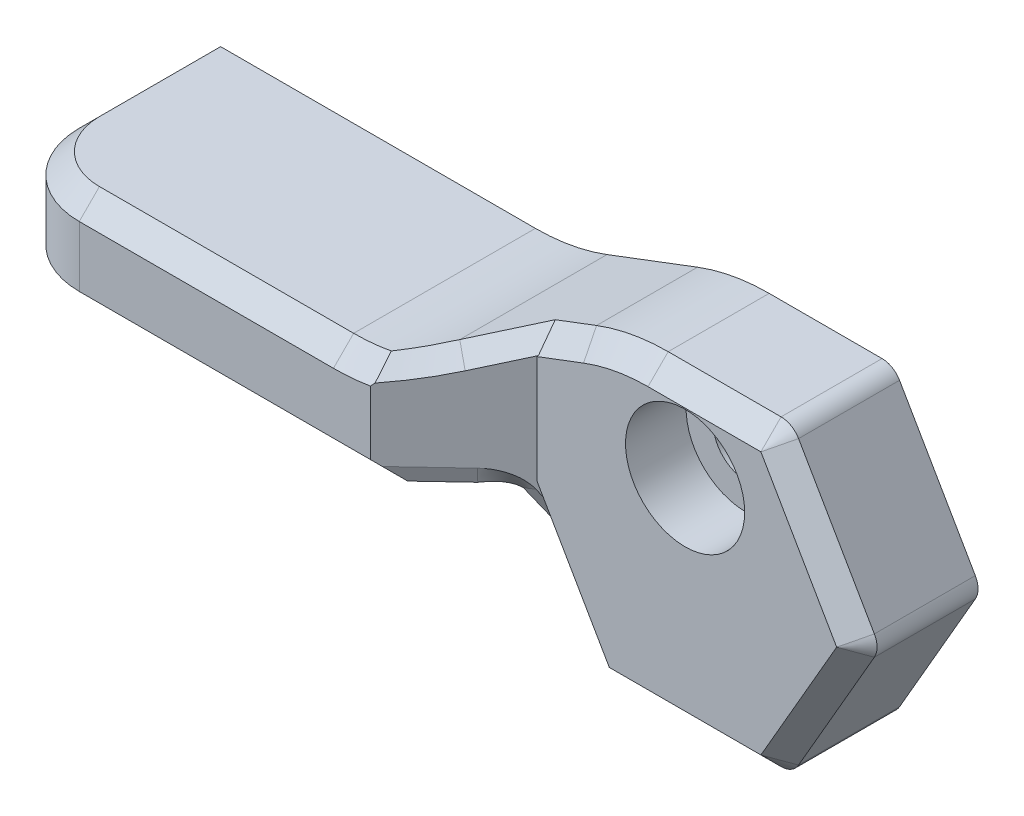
SolidWorks part; units mm, degrees
ref_plane "Спереди" through (0, 0, 0) normal (0, 0, 1) x (1, 0, 0)
ref_plane "Сверху" through (0, 0, 0) normal (0, 1, 0) x (1, 0, 0)
ref_plane "Справа" through (0, 0, 0) normal (1, 0, 0) x (0, 0, -1)
sketch "Эскиз1" plane through (0, 0, 0) normal (0, 0, 1) x (1, 0, 0)
  line L0 (0, 5.9013) -> (0, 0) construction
  line L1 (0, 0) -> (7.6127, 0) construction
  line L2 (-30, 4.5) -> (-11.58, 4.5)
  line L3 (8.6603, 0) -> (4.3301, 7.5)
  line L4 (4.3301, 7.5) -> (-3.6699, 7.5)
  line L5 (-11.58, 4.5) -> (-3.6699, 7.5)
  line L6 (-8.3716, -0.5) -> (-4.3301, -7.5)
  line L7 (-4.3301, -7.5) -> (4.3301, -7.5)
  line L8 (4.3301, -7.5) -> (8.6603, 0)
  line L9 (-30, 4.5) -> (-30, -0.5)
  line L10 (-30, -0.5) -> (-8.3716, -0.5)
  line L12 (-6.4952, 3.75) -> (-8.8046, -0.25)
  circle A0 centre (0, 0) radius 1.5 construction
  circle A1 centre (0, 0) radius 7.5 construction
  dimension "D1" = 3
  dimension "D2" = 15
  dimension "D5" = 8
  dimension "D3" = 30
  dimension "D4" = 5
  dimension "D6" = 3
extrude "Бобышка-Вытянуть1" add sketch "Эскиз1" along normal blind 10
fillet "Скругление1" radius 1 1 edges at (-8.3716, -0.5, 5)
fillet "Скругление2" radius 1 4 edges at (-4.3301, -7.5, 5) (4.3301, -7.5, 5) (8.6603, 0, 5) (4.3301, 7.5, 5)
sketch "Эскиз8" plane through (0, 7.5, 0) normal (0, 1, 0) x (1, 0, 0)
  line L0 (-11.58, -10) -> (-7.3266, -6)
  line L1 (-7.3266, -6) -> (8.5056, -6)
  line L3 (8.5056, -6) -> (8.5056, -10)
  line L4 (8.5056, -10) -> (-11.58, -10)
  dimension "D1" = 6
extrude "Вырез-Вытянуть6" cut sketch "Эскиз8" against normal through all
sketch "Эскиз3" plane through (0, 0, 10) normal (0, 0, 1) x (1, 0, 0)
  line L0 (0, 0) -> (0, -7.5) construction
  line L2 (-3.7528, -7.5) -> (3.7528, -7.5) construction
  circle A0 centre (0, 3.5) radius 1.6
  dimension "D1" = 3.2
  dimension "D2" = 3.5
extrude "Вырез-Вытянуть2" cut sketch "Эскиз3" against normal through all
sketch "Эскиз6" plane through (0, 0, 6) normal (0, 0, 1) x (1, 0, 0)
  circle A0 centre (0, 3.5) radius 2.95
  dimension "D1" = 5.9
extrude "Вырез-Вытянуть5" cut sketch "Эскиз6" against normal blind 3
fillet "Скругление3" radius 10 2 edges at (-11.58, 4.5, 5) (-3.6699, 7.5, 3)
fillet "Скругление4" radius 4 1 edges at (-30, 2, 10)
chamfer "Фаска1" distance 1 angle 45 23 edges at (-6.355, 6.4816, 6) (-19.7063, 4.5, 10) (-8.5965, 5.6315, 7.1943) (-10.7125, 4.8714, 9.1842) (-5.9727, -4.655, 6) (-4.2528, -7.366, 6) (0, -7.5, 6) (4.2528, -7.366, 6) (6.4952, -3.75, 6) (8.5056, 0, 6) (6.4952, 3.75, 6) (4.2528, 7.366, 6) (0.9578, 7.5, 6) (-3.6399, 7.3362, 6) (-30, -0.5, 3) (-28.8284, -0.5, 8.8284) (-18.79, -0.5, 10) (-10.2645, -0.5, 8.7628) (-8.4489, -0.634, 7.0555) (-7.7047, -1.655, 6.3556) (-30, 4.5, 3) (-28.8284, 4.5, 8.8284) (-12.4924, 4.5424, 10)
